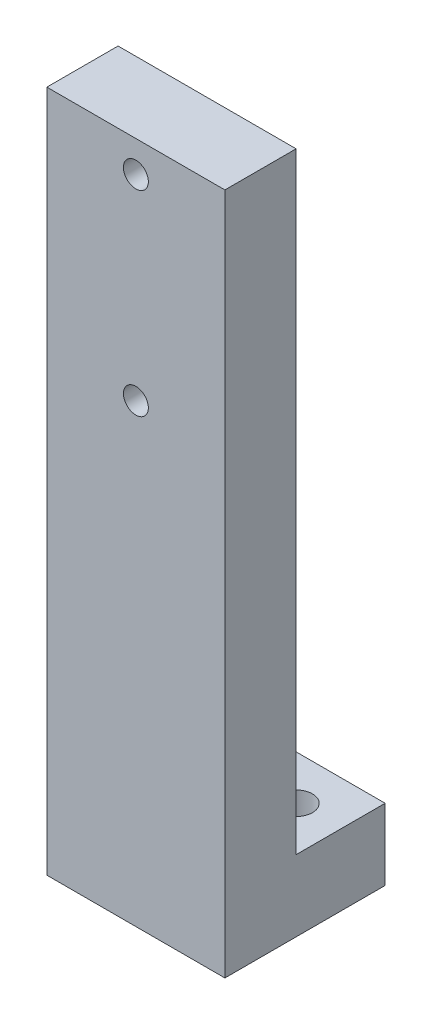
SolidWorks part; units mm, degrees
ref_plane "前视基准面" through (0, 0, 0) normal (0, 0, 1) x (1, 0, 0)
ref_plane "上视基准面" through (0, 0, 0) normal (0, 1, 0) x (1, 0, 0)
ref_plane "右视基准面" through (0, 0, 0) normal (1, 0, 0) x (0, 0, -1)
sketch "草图1" plane through (0, 0, 0) normal (0, 0, 1) x (1, 0, 0)
  line L0 (0, 0) -> (0, 115)
  line L1 (30, 0) -> (30, 115)
  line L2 (0, 0) -> (30, 0)
  line L3 (0, 115) -> (30, 115)
  circle A0 centre (15, 109.74) radius 2.1
  circle A1 centre (15, 76.74) radius 2.1
extrude "凸台-拉伸1" add sketch "草图1" along normal blind 27
sketch "草图2" plane through (30, 0, 0) normal (1, 0, 0) x (0, 0, -1)
  line L0 (-15, 12) -> (-15, 115)
  line L1 (-15, 12) -> (0, 12)
extrude "切除-拉伸1" cut sketch "草图2" against normal through all and the other way through all
sketch "草图3" plane through (0, 12, 0) normal (0, 1, 0) x (1, 0, 0)
  circle A0 centre (7.5, -7.5) radius 2.75
  circle A1 centre (22.5, -7.5) radius 2.75
extrude "切除-拉伸2" cut sketch "草图3" against normal blind 27
